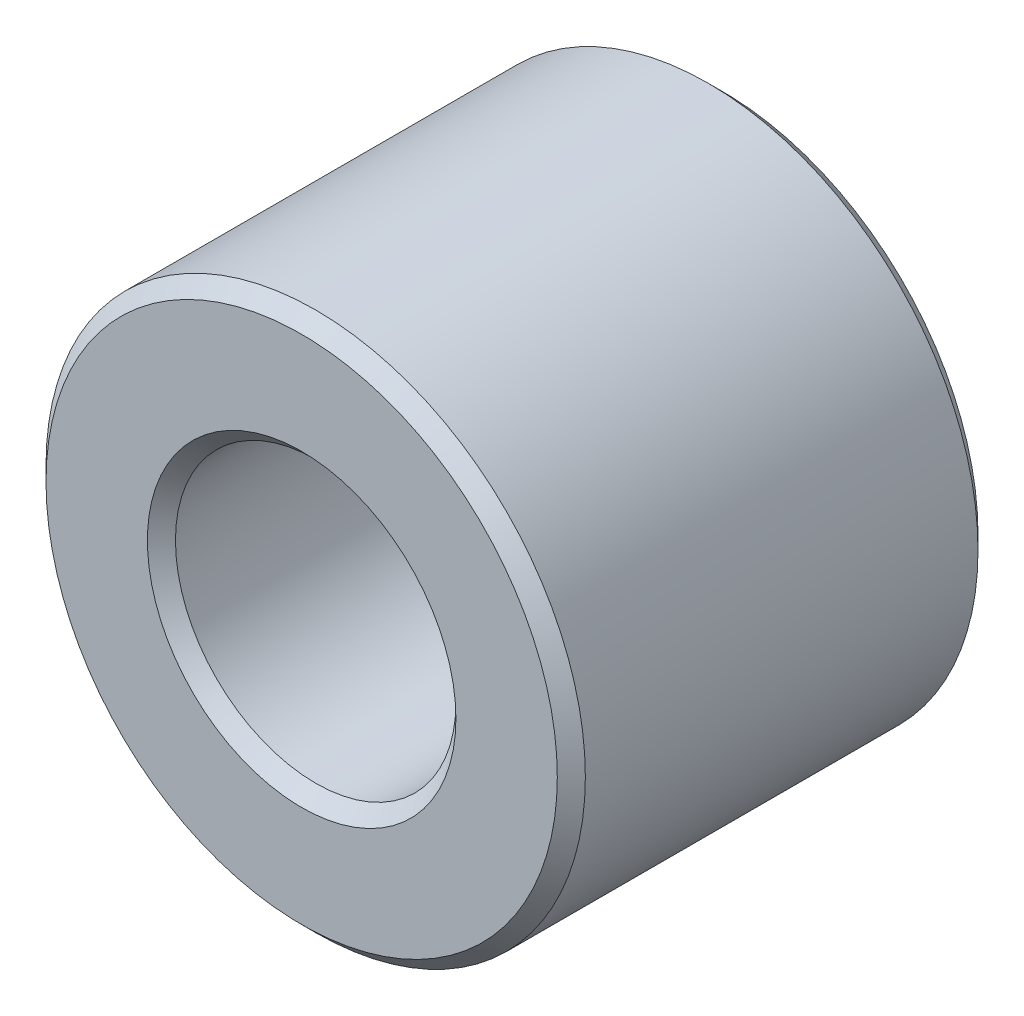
SolidWorks part; units mm, degrees
ref_plane "Front Plane" through (0, 0, 0) normal (0, 0, 1) x (1, 0, 0)
ref_plane "Top Plane" through (0, 0, 0) normal (0, 1, 0) x (1, 0, 0)
ref_plane "Right Plane" through (0, 0, 0) normal (1, 0, 0) x (0, 0, -1)
sketch "Sketch1" plane through (0, 0, 0) normal (0, 0, 1) x (1, 0, 0)
  circle A0 centre (0, 0) radius 13
  circle A1 centre (0, 0) radius 25
  dimension "D1" = 26
  dimension "D2" = 50
extrude "Boss-Extrude1" add sketch "Sketch1" along normal mid plane 39
chamfer "Chamfer1" distance 1.3 angle 45 4 edges at (13, 0, -19.5) (25, 0, -19.5) (13, 0, 19.5) (25, 0, 19.5)
